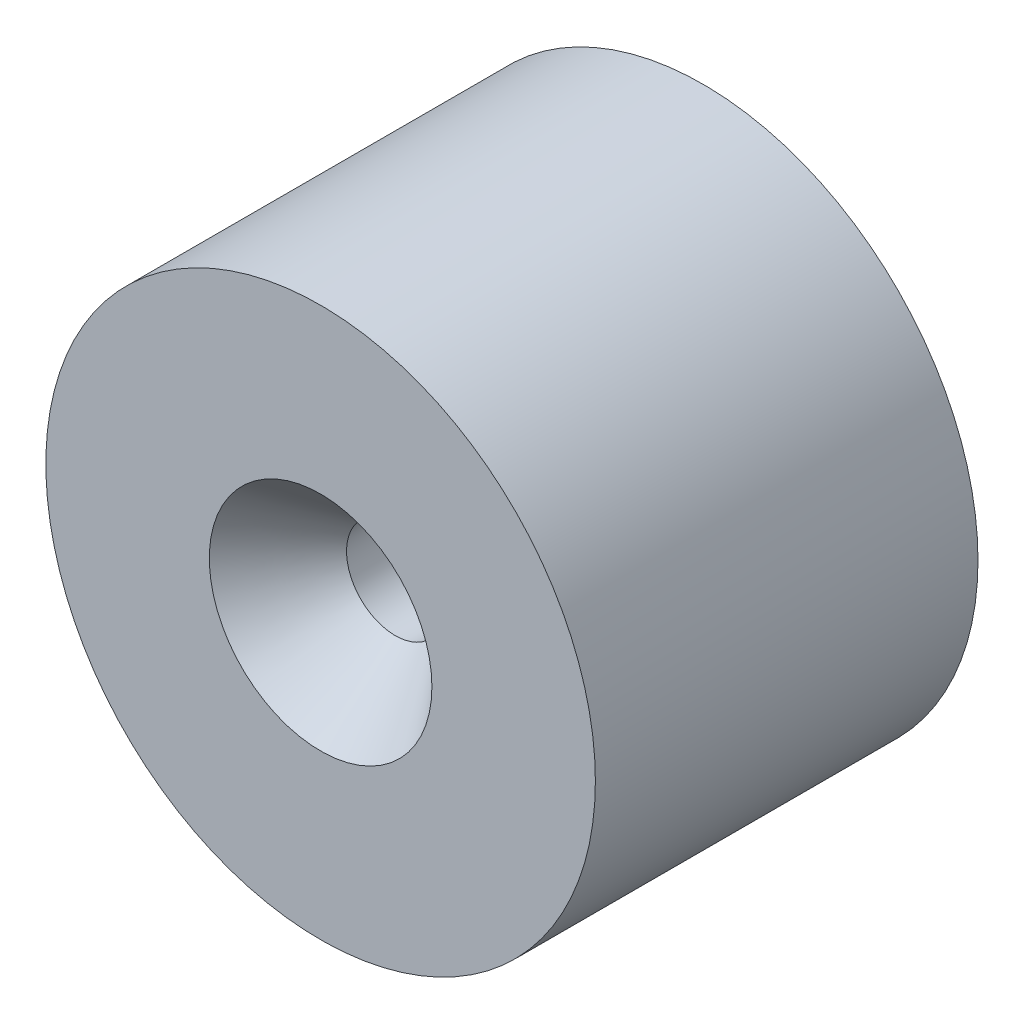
SolidWorks part; units mm, degrees
ref_plane "Front Plane" through (0, 0, 0) normal (0, 0, 1) x (1, 0, 0)
ref_plane "Top Plane" through (0, 0, 0) normal (0, 1, 0) x (1, 0, 0)
ref_plane "Right Plane" through (0, 0, 0) normal (1, 0, 0) x (0, 0, -1)
sketch "Sketch1" plane through (0, 0, 0) normal (0, 0, 1) x (1, 0, 0)
  circle A0 centre (0, 0) radius 1.4
  dimension "D1" = 2.8
extrude "Extrude-Thin1" add sketch "Sketch1" along normal blind 11 thin
ref_plane "Plane1" through (0, 0, 2) normal (0, 0, -1) x (-1, 0, 0)
sketch "Sketch4" plane through (0, 0, 2) normal (0, 0, -1) x (-1, 0, 0)
  circle A0 centre (0, 0) radius 3.5
  circle A1 centre (0, 0) radius 7.9 construction
  circle A2 centre (0, 0) radius 5.3
  dimension "D1" = 7
  dimension "D2" = 2.6
extrude "Cut-Extrude1" cut sketch "Sketch4" against normal blind 7
hole_wizard "CSK for M3 Flat Head Machine Screw1" positions "Sketch2" profile "Sketch3" countersink size "M3" standard "ANSI Metric"
sketch "Sketch2" plane through (0, 0, 11) normal (0, 0, 1) x (1, 0, 0)
  point P0 (0, 0)
sketch "Sketch3" plane through (0, 0, 11) normal (1, 0, 0) x (0, -1, 0)
  line L0 (0, 0) -> (0, 14.8412)
  line L1 (0, 14.8412) -> (1.4, 14)
  line L2 (1.4, 14) -> (1.4, 2.1452)
  line L3 (1.4, 2.1452) -> (3.2, 0)
  line L5 (3.2, 0) -> (0, 0)
  line L6 (-1.4, 2.1452) -> (-3.2, 0) construction
  line L10 (0, 14.8412) -> (-1.4, 14) construction
  line L11 (0, -6.35) -> (0, 107.95) construction
  dimension "Hole Dia." = 2.8
  dimension "Hole Depth" = 14
  dimension "Near C'Sink Dia." = 6.4
  dimension "Near C'Sink Angle" = 80
  dimension "Drill Angle" = 118
